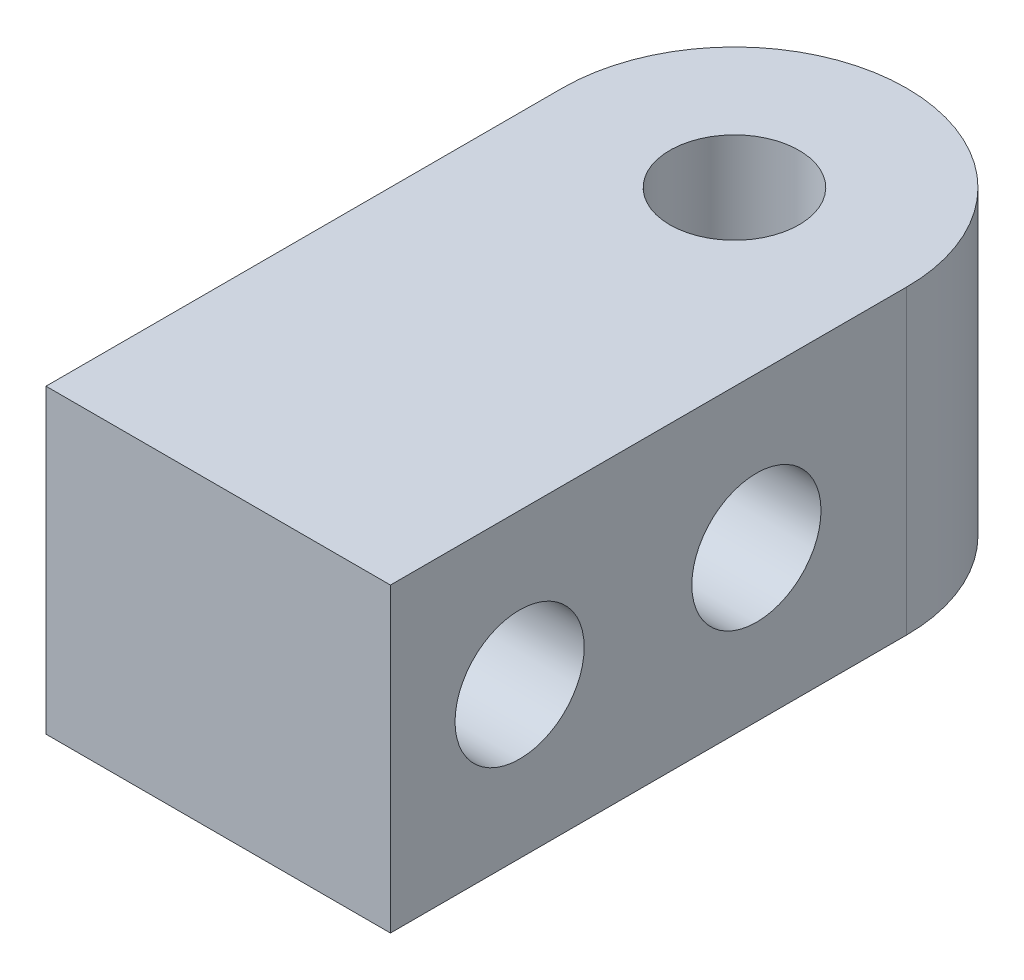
SolidWorks part; units mm, degrees
ref_plane "Front Plane" through (0, 0, 0) normal (0, 0, 1) x (1, 0, 0)
ref_plane "Top Plane" through (0, 0, 0) normal (0, 1, 0) x (1, 0, 0)
ref_plane "Right Plane" through (0, 0, 0) normal (1, 0, 0) x (0, 0, -1)
sketch "Sketch1" plane through (0, 0, 0) normal (0, 1, 0) x (1, 0, 0)
  line L1 (-4, 0.0103) -> (4, 0.0103)
  line L2 (-4, 0.0103) -> (-4, -11.9897)
  line L3 (-4, -11.9897) -> (4, -11.9897)
  line L4 (4, 0.0103) -> (4, -11.9897)
  circle A0 centre (0, 0) radius 4
  circle A1 centre (0, 0) radius 1.5
  dimension "D1" = 8
  dimension "D3" = 3
  dimension "D2" = 12
extrude "Boss-Extrude1" add sketch "Sketch1" along normal blind 7 contours A1 L1 A0 | A1 L1 L2 A0 | A0 L2 L3 L4
sketch "Sketch2" plane through (-4, 0, 0) normal (-1, 0, 0) x (0, 0, 1)
  line L1 (-0.0103, 7) -> (-0.0103, 0) construction
  circle A2 centre (3.4897, 3.5) radius 1.5
  circle A4 centre (8.9897, 3.5) radius 1.5
  dimension "D1" = 3
  dimension "D4" = 3.5
  dimension "D2" = 5.5
extrude "Cut-Extrude1" cut sketch "Sketch2" against normal blind 18
